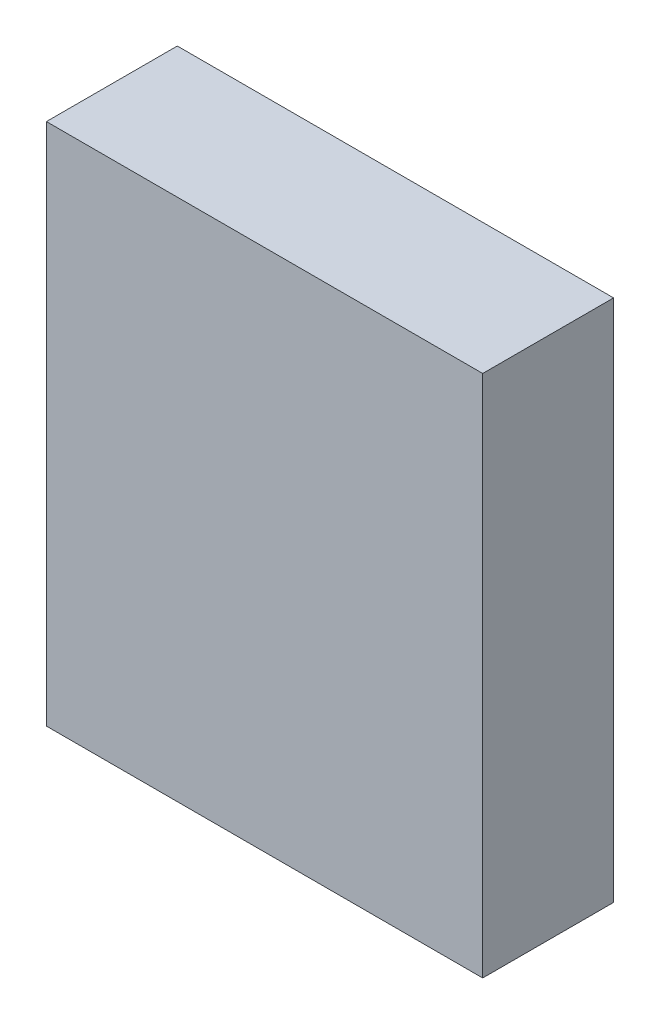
SolidWorks part; units mm, degrees
ref_plane "Front Plane" through (0, 0, 0) normal (0, 0, 1) x (1, 0, 0)
ref_plane "Top Plane" through (0, 0, 0) normal (0, 1, 0) x (1, 0, 0)
ref_plane "Right Plane" through (0, 0, 0) normal (1, 0, 0) x (0, 0, -1)
sketch "Sketch1" plane through (0, 0, 0) normal (0, 1, 0) x (1, 0, 0)
  line L1 (-25, 10) -> (25, 10)
  line L2 (-25, 10) -> (-25, -5)
  line L3 (-25, -5) -> (25, -5)
  line L4 (25, 10) -> (25, -5)
  dimension "D1" = 15
  dimension "D2" = 50
  dimension "D3" = 25
  dimension "D4" = 10
extrude "Extrude1" add sketch "Sketch1" along normal blind 60
ref_plane "Plane2" through (0, 30, 0) normal (0, 1, 0) x (-1, 0, 0)
sketch "Sketch2" plane through (0, 30, 0) normal (0, 1, 0) x (-1, 0, 0)
  line L1 (-25, 5) -> (25, 5)
  line L2 (-25, 5) -> (-25, -10)
  line L3 (-25, -10) -> (25, -10)
  line L4 (25, 5) -> (25, -10)
